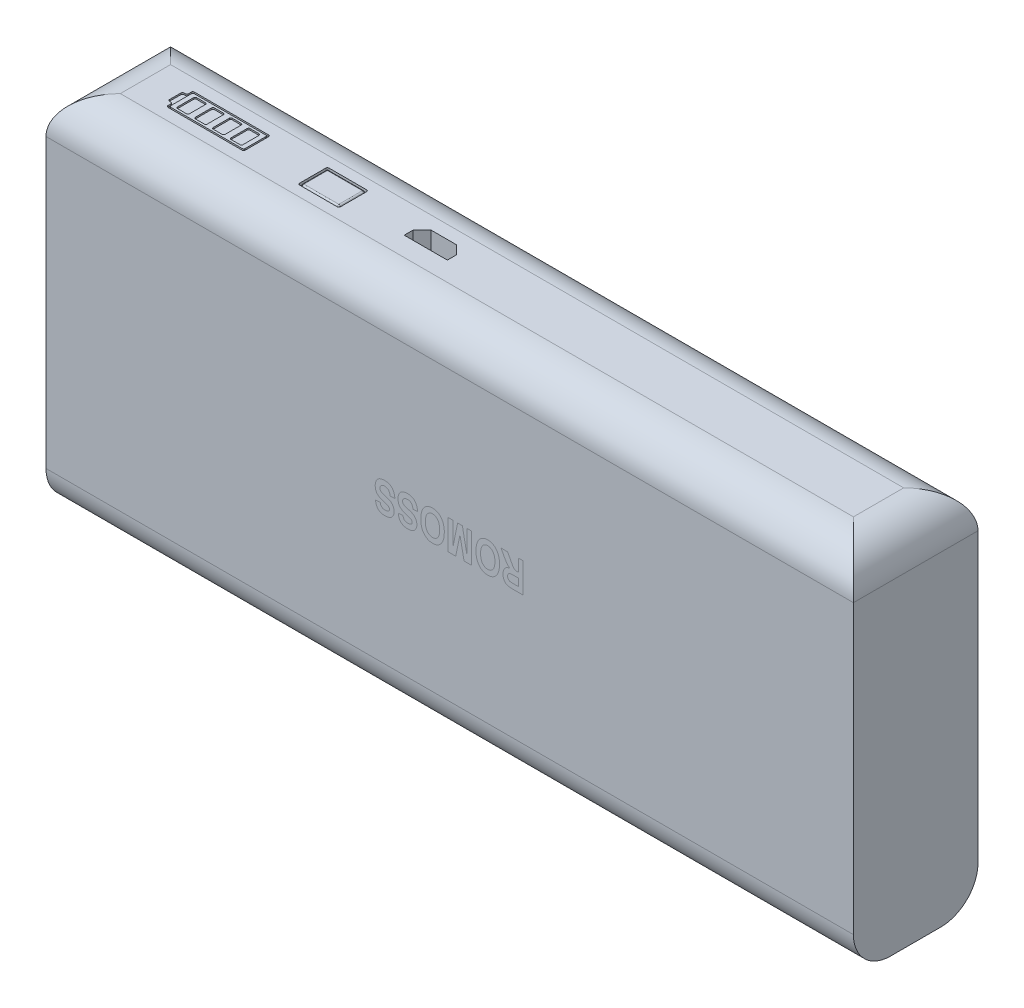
SolidWorks part; units mm, degrees
ref_plane "Front Plane" through (0, 0, 0) normal (0, 0, 1) x (1, 0, 0)
ref_plane "Top Plane" through (0, 0, 0) normal (0, 1, 0) x (1, 0, 0)
ref_plane "Right Plane" through (0, 0, 0) normal (1, 0, 0) x (0, 0, -1)
sketch "Sketch1" plane through (0, 0, 0) normal (0, 1, 0) x (1, 0, 0)
  line L1 (-68.9864, 10.6426) -> (68.9864, 10.6426)
  line L2 (-68.9864, 10.6426) -> (-68.9864, -10.6426)
  line L3 (-68.9864, -10.6426) -> (68.9864, -10.6426)
  line L4 (68.9864, 10.6426) -> (68.9864, -10.6426)
  line L5 (-68.9864, 10.6426) -> (68.9864, -10.6426) construction
  line L6 (-68.9864, -10.6426) -> (68.9864, 10.6426) construction
  point P0 (0, 0)
  dimension "D1" = 137.9728
  dimension "D2" = 21.2852
extrude "Boss-Extrude1" add sketch "Sketch1" along normal blind 61.8236
fillet "Fillet10" radius 6.35 4 edges at (-68.9864, 61.8236, 0) (0, 61.8236, 10.6426) (0, 61.8236, -10.6426) (68.9864, 61.8236, 0)
fillet "Fillet11" radius 6.35 2 edges at (0, 0, 10.6426) (0, 0, -10.6426)
sketch "Sketch3" plane through (0, 0, 10.6426) normal (0, 0, 1) x (1, 0, 0)
  line L0 (-68.9864, 33.4518) -> (68.9864, 33.4518) construction
  line L4 (-62.6364, 61.8236) -> (62.6364, 61.8236) construction
  line L5 (-68.9864, 55.4736) -> (-68.9864, 6.35) construction
  line L6 (68.9864, 55.4736) -> (68.9864, 6.35) construction
  line L7 (-68.9864, 6.35) -> (68.9864, 6.35) construction
  text T0 "ROMOSS  " font "Arial Narrow" height 5.08
  dimension "D1" = 28.3718
sketch "Sketch5" plane through (0, 61.8236, 0) normal (0, 1, 0) x (1, 0, 0)
  line L0 (-56.7944, 2.2606) -> (-56.7944, 1.2446)
  line L1 (-56.5404, 2.0066) -> (-43.8404, 2.0066)
  line L2 (-56.5404, 2.0066) -> (-56.5404, -2.0066)
  line L3 (-56.5404, -2.0066) -> (-43.8404, -2.0066)
  line L4 (-43.8404, 2.0066) -> (-43.8404, -2.0066)
  line L5 (-56.7944, -2.2606) -> (-43.5864, -2.2606)
  line L6 (-43.5864, 2.2606) -> (-43.5864, -2.2606)
  line L7 (-56.7944, 2.2606) -> (-43.5864, 2.2606)
  line L8 (-56.7944, 1.2446) -> (-57.5564, 1.2446)
  line L9 (-57.5564, 1.2446) -> (-57.5564, -1.2446)
  line L10 (-57.5564, -1.2446) -> (-56.7944, -1.2446)
  line L11 (-56.7944, -1.2446) -> (-56.7944, -2.2606)
  line L12 (-56.7944, 2.2606) -> (-56.7944, -2.2606) construction
  line L13 (-62.6364, 4.2926) -> (-62.6364, -4.2926) construction
  line L14 (-62.6364, -4.2926) -> (62.6364, -4.2926) construction
  line L17 (62.6364, 4.2926) -> (-62.6364, 4.2926) construction
  dimension "D2" = 2.032
  dimension "D3" = 12.7
  dimension "D4" = 1.016
  dimension "D5" = 1.016
  dimension "D6" = 1.016
  dimension "D7" = 5.08
  dimension "D8" = 2.032
  dimension "D1" = 0.254
extrude "Cut-Extrude1" cut sketch "Sketch5" against normal blind 0.254
fillet "Fillet12" radius 0.254 12 edges at (-43.5864, 61.6966, -2.2606) (-43.5864, 61.6966, 2.2606) (-43.8404, 61.6966, -2.0066) (-43.8404, 61.6966, 2.0066) (-56.5404, 61.6966, -2.0066) (-56.5404, 61.6966, 2.0066) (-56.7944, 61.6966, 2.2606) (-56.7944, 61.6966, 1.2446) (-56.7944, 61.6966, -1.2446) (-56.7944, 61.6966, -2.2606) (-57.5564, 61.6966, -1.2446) (-57.5564, 61.6966, 1.2446)
sketch "Sketch6" plane through (0, 61.8236, 0) normal (0, 1, 0) x (1, 0, 0)
  line L0 (-44.0944, 2.0066) -> (-56.2864, 2.0066) construction
  line L1 (-55.7784, 1.6256) -> (-53.7464, 1.6256)
  line L2 (-55.7784, 1.6256) -> (-55.7784, -1.6256)
  line L3 (-55.7784, -1.6256) -> (-53.7464, -1.6256)
  line L4 (-53.7464, 1.6256) -> (-53.7464, -1.6256)
  line L5 (-56.2864, -2.0066) -> (-44.0944, -2.0066) construction
  line L6 (-56.5404, 1.7526) -> (-56.5404, -1.7526) construction
  point P6 (-54.7624, -1.6256)
  dimension "D1" = 2.032
  dimension "D2" = 0.381
  dimension "D3" = 0.381
  dimension "D4" = 0.762
extrude "Cut-Extrude2" cut sketch "Sketch6" against normal blind 0.254
fillet "Fillet13" radius 0.254 4 edges at (-53.7464, 61.6966, 1.6256) (-55.7784, 61.6966, 1.6256) (-53.7464, 61.6966, -1.6256) (-55.7784, 61.6966, -1.6256)
pattern_linear "LPattern1" count 4 spacing 3.048 along (1, 0, 0) of "Fillet13", "Cut-Extrude2"
sketch "Sketch7" plane through (0, 61.8236, 0) normal (0, 1, 0) x (1, 0, 0)
  line L1 (-34.0614, 2.5146) -> (-27.0764, 2.5146)
  line L2 (-34.0614, 2.5146) -> (-34.0614, -2.5146)
  line L3 (-34.0614, -2.5146) -> (-27.0764, -2.5146)
  line L4 (-27.0764, 2.5146) -> (-27.0764, -2.5146)
  line L6 (-43.5864, -2.0066) -> (-43.5864, 2.0066) construction
  line L9 (-62.6364, -4.2926) -> (62.6364, -4.2926) construction
  line L10 (62.6364, 4.2926) -> (-62.6364, 4.2926) construction
  dimension "D1" = 6.985
  dimension "D3" = 9.525
  dimension "D4" = 1.778
  dimension "D5" = 1.778
extrude "Cut-Extrude3" cut sketch "Sketch7" against normal blind 0.508
sketch "Sketch8" plane through (0, 61.3156, 0) normal (0, 1, 0) x (1, 0, 0)
  line L0 (-34.0614, -2.5146) -> (-27.0764, -2.5146) construction
  line L1 (-33.8074, 2.2606) -> (-27.3304, 2.2606)
  line L2 (-33.8074, 2.2606) -> (-33.8074, -2.2606)
  line L3 (-33.8074, -2.2606) -> (-27.3304, -2.2606)
  line L4 (-27.3304, 2.2606) -> (-27.3304, -2.2606)
  line L5 (-27.0764, 2.5146) -> (-34.0614, 2.5146) construction
  line L6 (-34.0614, 2.5146) -> (-34.0614, -2.5146) construction
  line L7 (-27.0764, -2.5146) -> (-27.0764, 2.5146) construction
  dimension "D1" = 0.254
  dimension "D2" = 0.254
  dimension "D3" = 0.254
  dimension "D4" = 0.254
extrude "Boss-Extrude2" add sketch "Sketch8" along normal blind 0.508
fillet "Fillet15" radius 0.254 4 edges at (-27.0764, 61.5696, 2.5146) (-27.0764, 61.5696, -2.5146) (-34.0614, 61.5696, -2.5146) (-34.0614, 61.5696, 2.5146)
fillet "Fillet16" radius 0.254 8 edges at (-30.5689, 61.8236, -2.2606) (-27.3304, 61.8236, 0) (-30.5689, 61.8236, 2.2606) (-33.8074, 61.8236, 0) (-33.8074, 61.5696, -2.2606) (-27.3304, 61.5696, -2.2606) (-27.3304, 61.5696, 2.2606) (-33.8074, 61.5696, 2.2606)
sketch "Sketch9" plane through (0, 61.8236, 0) normal (0, 1, 0) x (1, 0, 0)
  line L0 (-17.4244, -0.9906) -> (-10.0584, -0.9906)
  line L1 (-10.0584, -0.9906) -> (-10.0584, 0.5334)
  line L2 (-10.0584, 0.5334) -> (-11.5824, 2.0574)
  line L3 (-11.5824, 2.0574) -> (-15.9004, 2.0574)
  line L4 (-15.9004, 2.0574) -> (-17.4244, 0.5334)
  line L5 (-17.4244, 0.5334) -> (-17.4244, -0.9906)
  line L6 (-62.6364, -4.2926) -> (62.6364, -4.2926) construction
  line L7 (-27.0764, -2.2606) -> (-27.0764, 2.2606) construction
  point P2 (-13.7414, -0.9906)
  point P7 (-13.7414, 2.0574)
  dimension "D1" = 7.366
  dimension "D2" = 3.048
  dimension "D3" = 1.524
  dimension "D4" = 135
  dimension "D5" = 3.302
  dimension "D6" = 9.652
extrude "Cut-Extrude4" cut sketch "Sketch9" against normal blind 6.35
sketch "Sketch10" plane through (-68.9864, 0, 0) normal (-1, 0, 0) x (0, 0, 1)
  line L0 (-10.6426, 55.4736) -> (-10.6426, 6.35) construction
  line L1 (-7.5946, 55.4736) -> (-2.5146, 55.4736)
  line L2 (-7.5946, 55.4736) -> (-7.5946, 42.7736)
  line L3 (-7.5946, 42.7736) -> (-2.5146, 42.7736)
  line L4 (-2.5146, 55.4736) -> (-2.5146, 42.7736)
  line L5 (10.6426, 55.4736) -> (-10.6426, 55.4736) construction
  line L6 (10.6426, 55.4736) -> (10.6426, 6.35) construction
  line L7 (0.9906, 55.4736) -> (6.0706, 55.4736)
  line L8 (0.9906, 55.4736) -> (0.9906, 42.7736)
  line L9 (0.9906, 42.7736) -> (6.0706, 42.7736)
  line L10 (6.0706, 55.4736) -> (6.0706, 42.7736)
  dimension "D1" = 12.7
  dimension "D2" = 5.08
  dimension "D3" = 3.048
  dimension "D4" = 4.572
extrude "Cut-Extrude5" cut sketch "Sketch10" against normal blind 15.24
sketch "Sketch11" plane through (-53.7464, 0, 0) normal (-1, 0, 0) x (0, 0, 1)
  line L0 (-7.5946, 42.7736) -> (-2.5146, 42.7736) construction
  line L1 (-6.0706, 54.8386) -> (-4.8006, 54.8386)
  line L2 (-6.0706, 54.8386) -> (-6.0706, 43.4086)
  line L3 (-6.0706, 43.4086) -> (-4.8006, 43.4086)
  line L4 (-4.8006, 54.8386) -> (-4.8006, 43.4086)
  line L5 (-6.0706, 54.8386) -> (-4.8006, 43.4086) construction
  line L6 (-6.0706, 43.4086) -> (-4.8006, 54.8386) construction
  line L7 (-7.5946, 55.4736) -> (-7.5946, 42.7736) construction
  line L8 (0.9906, 55.4736) -> (0.9906, 42.7736) construction
  line L9 (2.5146, 54.8386) -> (3.7846, 54.8386)
  line L10 (2.5146, 54.8386) -> (2.5146, 43.4086)
  line L11 (2.5146, 43.4086) -> (3.7846, 43.4086)
  line L12 (3.7846, 54.8386) -> (3.7846, 43.4086)
  line L13 (2.5146, 54.8386) -> (3.7846, 43.4086) construction
  line L14 (2.5146, 43.4086) -> (3.7846, 54.8386) construction
  point P0 (-5.4356, 49.1236)
  point P9 (3.1496, 49.1236)
  dimension "D1" = 6.35
  dimension "D2" = 1.524
  dimension "D3" = 11.43
  dimension "D4" = 1.27
  dimension "D5" = 1.524
extrude "Boss-Extrude3" add sketch "Sketch11" along normal blind 11.43
chamfer "Chamfer2" distance 0.508 angle 30 8 edges at (-65.1764, 43.4086, -5.4356) (-65.1764, 49.1236, -6.0706) (-65.1764, 54.8386, -5.4356) (-65.1764, 49.1236, -4.8006) (-65.1764, 43.4086, 3.1496) (-65.1764, 49.1236, 2.5146) (-65.1764, 54.8386, 3.1496) (-65.1764, 49.1236, 3.7846)
sketch "Sketch12" plane through (-68.9864, 0, 0) normal (-1, 0, 0) x (0, 0, 1)
  line L0 (3.5306, 39.4716) -> (3.5306, 37.9476) construction
  line L1 (4.8006, 39.4716) -> (4.8006, 37.9476)
  line L2 (2.2606, 39.4716) -> (2.2606, 37.9476)
  line L3 (0.9906, 42.7736) -> (6.0706, 42.7736) construction
  line L4 (-7.5946, 42.7736) -> (-2.5146, 42.7736) construction
  circle A0 centre (-5.0546, 38.7096) radius 1.27
  arc A1 (4.8006, 39.4716) -> (2.2606, 39.4716) centre (3.5306, 39.4716) ccw
  arc A2 (2.2606, 37.9476) -> (4.8006, 37.9476) centre (3.5306, 37.9476) ccw
  point P4 (3.5306, 38.7096)
  point P11 (3.5306, 42.7736)
  point P14 (-5.0546, 42.7736)
  point P15 (3.5306, 40.7416)
  point P16 (3.5306, 36.6776)
  dimension "D1" = 2.54
  dimension "D2" = 4.064
  dimension "D3" = 4.064
extrude "Cut-Extrude6" cut sketch "Sketch12" against normal blind 0.254
wrap "Wrap1" sketch "Sketch3" wrap type scribe source sketch "Sketch3"
